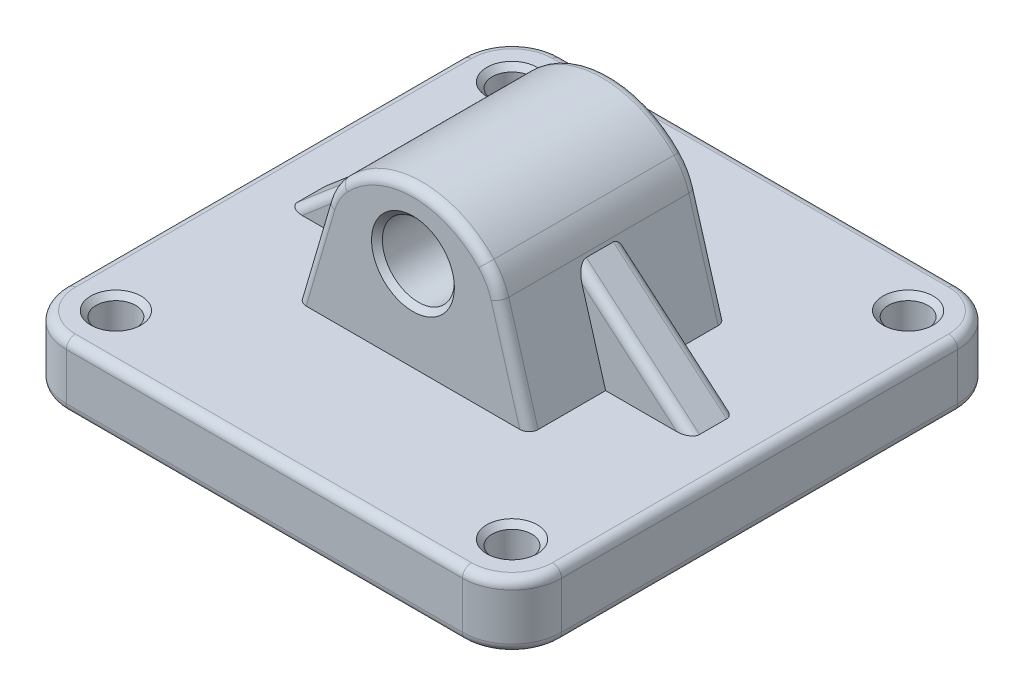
SolidWorks part; units mm, degrees
ref_plane "Front" through (0, 0, 0) normal (0, 0, 1) x (1, 0, 0)
ref_plane "Top" through (0, 0, 0) normal (0, 1, 0) x (1, 0, 0)
ref_plane "Right" through (0, 0, 0) normal (1, 0, 0) x (0, 0, -1)
sketch "Çizim2" plane through (0, 0, 0) normal (0, 1, 0) x (1, 0, 0)
  line L6 (-137.5, 110) -> (-137.5, -110)
  line L7 (-110, -137.5) -> (110, -137.5)
  line L8 (137.5, 110) -> (137.5, -110)
  line L9 (-110, 137.5) -> (110, 137.5)
  arc A0 (-110, 137.5) -> (-137.5, 110) centre (-110, 110) ccw
  arc A1 (110, 137.5) -> (137.5, 110) centre (110, 110) cw
  arc A2 (110, -137.5) -> (137.5, -110) centre (110, -110) ccw
  arc A3 (-110, -137.5) -> (-137.5, -110) centre (-110, -110) cw
  circle A4 centre (-110, 110) radius 11
  circle A5 centre (110, 110) radius 11
  circle A6 centre (110, -110) radius 11
  circle A7 centre (-110, -110) radius 11
  dimension "D1" = 22
extrude "Yükseklik-Ekstrüzyon1" add sketch "Çizim2" along normal blind 36
sketch "Çizim20" plane through (0, 0, 0) normal (0, -1, 0) x (1, 0, 0)
  circle A0 centre (0, 0) radius 105
  dimension "D1" = 210
extrude "Kes-Ekstrüzyon3" cut sketch "Çizim20" against normal blind 15 draft 22
ref_plane "Düzlem1" through (0, 0, 55) normal (0, 0, 1) x (1, 0, 0)
sketch "Çizim21" plane through (0, 0, 55) normal (0, 0, 1) x (1, 0, 0)
  line L0 (-64.5, 36) -> (64.5, 36)
  line L6 (-48.2176, 91.5517) -> (-64.5, 36)
  line L7 (48.2176, 91.5517) -> (64.5, 36)
  arc A0 (40.0381, 105.7791) -> (48.2176, 91.5517) centre (14.6306, 81.7072) cw
  arc A1 (-40.0381, 105.7791) -> (40.0381, 105.7791) centre (0, 67.8457) cw
  arc A2 (-40.0381, 105.7791) -> (-48.2176, 91.5517) centre (-14.6306, 81.7072) ccw
  circle A3 centre (0, 86) radius 20
  dimension "D1" = 35
  dimension "D2" = 40
  dimension "D3" = 50
extrude "Yükseklik-Ekstrüzyon2" add sketch "Çizim21" against normal blind 110
ref_plane "Düzlem2" through (0, 0, 0) normal (0, 0, 1) x (1, 0, 0)
sketch "Çizim24" plane through (0, 0, 0) normal (0, 0, 1) x (1, 0, 0)
  line L0 (48.7714, 89.6621) -> (111.6855, 36)
  line L1 (64.5, 36) -> (48.2176, 91.5517) construction
  line L3 (137.5, 36) -> (110, 36) construction
rib "Feder1" sketch "Çizim24" sketch "Çizim24" thickness 25 extrusion direction parallel to sketch draft on no parameters "D1"=25
mirror "Aynalama1" about plane through (0, 0, 0) normal (1, 0, 0) of "Feder1"
fillet "Radyus1" radius 5 30 edges at (-129.4454, 0, 129.4454) (-137.5, 0, 0) (-129.4454, 0, -129.4454) (0, 0, -137.5) (129.4454, 0, -129.4454) (137.5, 0, 0) (129.4454, 0, 129.4454) (-129.4454, 36, -129.4454) (0, 36, -137.5) (129.4454, 36, -129.4454) (137.5, 36, 0) (129.4454, 36, 129.4454) (0, 36, 137.5) (-129.4454, 36, 129.4454) (0, 0, 137.5) (-137.5, 36, 0) (80.2285, 62.8311, -12.5) (80.2285, 62.8311, 12.5) (-80.2285, 62.8311, -12.5) (-80.2285, 62.8311, 12.5) (56.3588, 63.7758, 55) (44.9735, 99.1516, 55) (-56.3588, 63.7758, 55) (-44.9735, 99.1516, 55) (56.3588, 63.7758, -55) (44.9735, 99.1516, -55) (-56.3588, 63.7758, -55) (-44.9735, 99.1516, -55) (0, 123, 55) (0, 123, -55)
chamfer "Pah1" distance 3 angle 45 10 edges at (-110, 0, -99) (-110, 0, 99) (110, 0, 121) (110, 0, -121) (20, 86, -55) (20, 86, 55) (110, 36, 121) (110, 36, -121) (-110, 36, -99) (-110, 36, 99)
